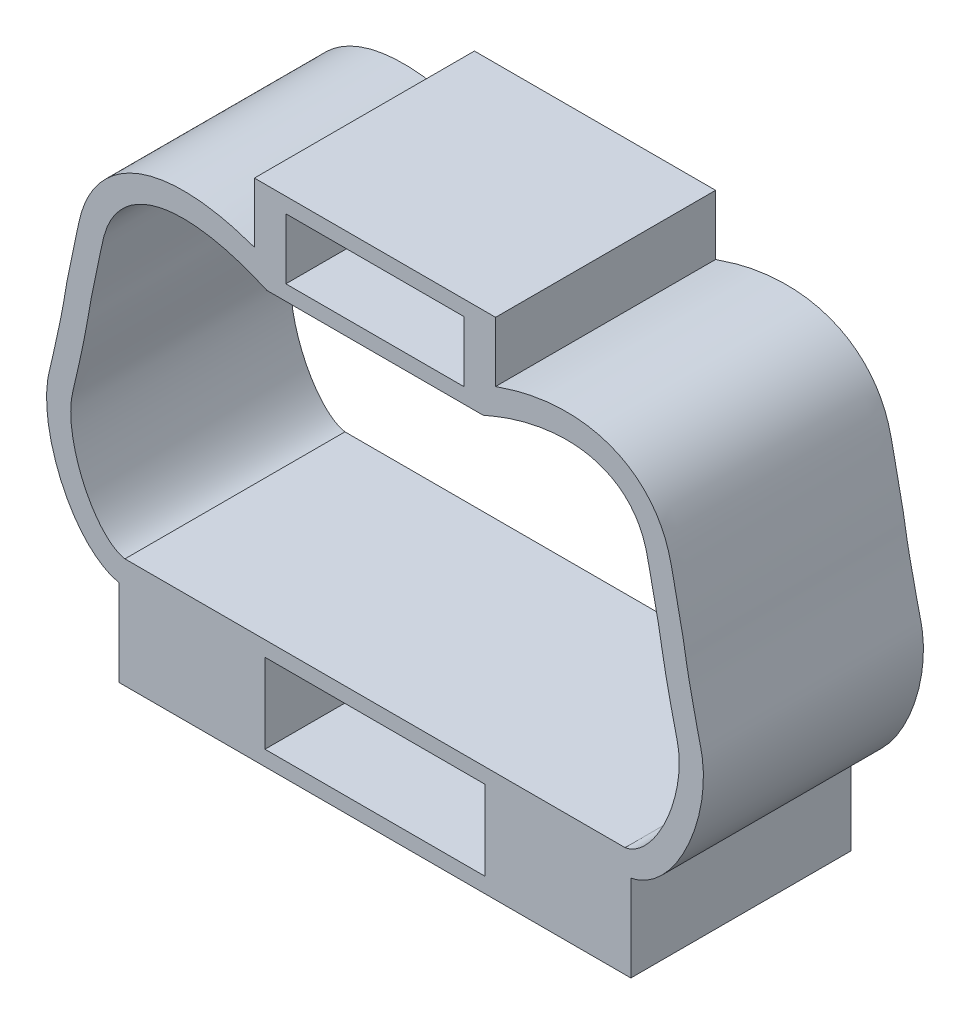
SolidWorks part; units mm, degrees
ref_plane "前视基准面" through (0, 0, 0) normal (0, 0, 1) x (1, 0, 0)
ref_plane "上视基准面" through (0, 0, 0) normal (0, 1, 0) x (1, 0, 0)
ref_plane "右视基准面" through (0, 0, 0) normal (1, 0, 0) x (0, 0, -1)
sketch "Model" plane through (0, 0, 0) normal (0, 0, 1) x (1, 0, 0)
  line L0 (6.5919, 0) -> (0, 0)
  line L1 (3.7419, 8) -> (6.5919, 8)
  line L2 (6.5919, 8) -> (6.5919, 8.4)
  line L3 (6.5919, 8.4) -> (4.2419, 8.4)
  line L4 (4.2419, 8.4) -> (4.2419, 10)
  line L5 (4.2419, 10) -> (6.5919, 10)
  line L6 (6.5919, 10) -> (6.5919, 10.4)
  line L7 (6.5919, 10.4) -> (3.4128, 10.4)
  line L8 (3.4128, 10.4) -> (3.4128, 8.8205)
  line L9 (-0.1534, -0.62) -> (-0.1534, -2.9)
  line L10 (-0.1534, -2.9) -> (6.5919, -2.9)
  line L11 (6.5919, -2.9) -> (6.5919, -2.5)
  line L12 (6.5919, -2.5) -> (3.6919, -2.5)
  line L13 (3.6919, -2.5) -> (3.6919, -0.4)
  line L14 (3.6919, -0.4) -> (6.5919, -0.4)
  line L15 (6.5919, -0.4) -> (6.5919, 0)
  spline S0 degree 3 number of poles 148 (0, 0) -> (3.7419, 8)
  spline S1 degree 3 number of poles 145 (3.4128, 8.8205) -> (-0.1534, -0.62)
extrude "凸台-拉伸1" add sketch "Model" along normal blind 5.8
ref_plane "基准面4" through (6.5919, 0, 0) normal (1, 0, 0) x (0, 0, -1)
mirror "镜向1" about plane through (6.5919, 8, 5.8) normal (-1, 0, 0) of "凸台-拉伸1"
